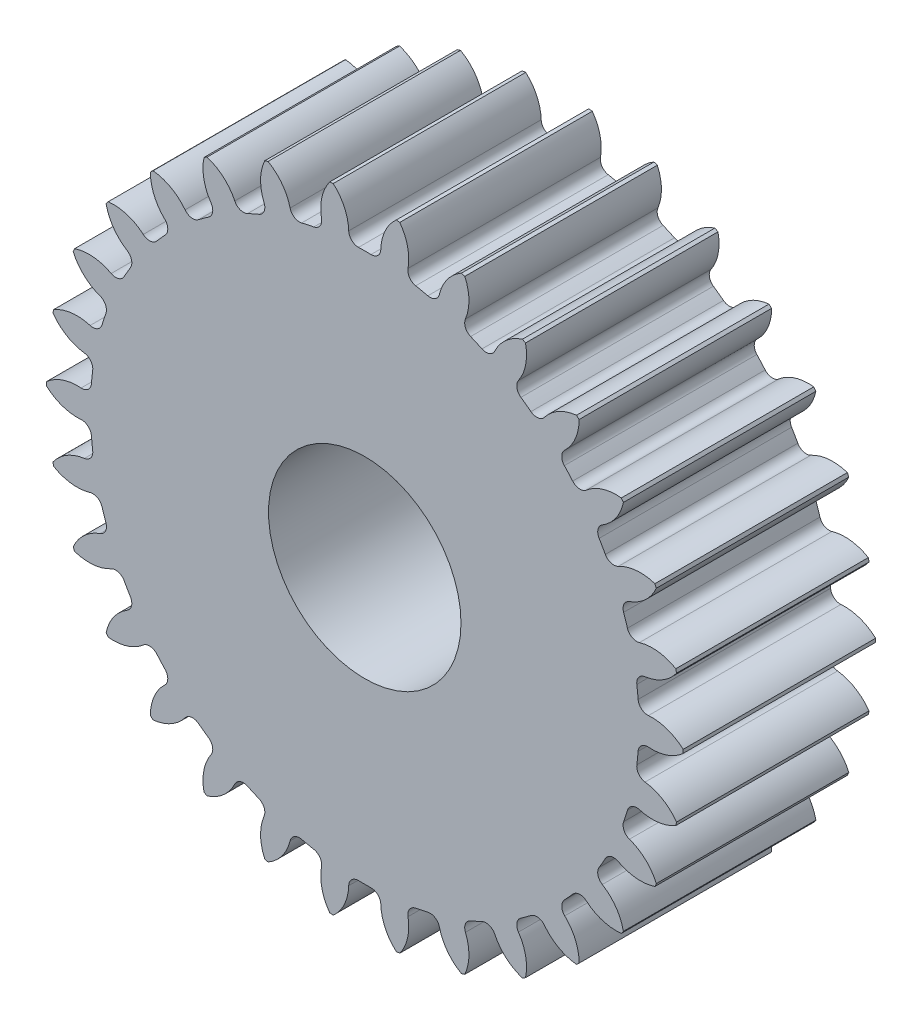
SolidWorks part; units mm, degrees
ref_plane "Front Plane" through (0, 0, 0) normal (0, 0, 1) x (1, 0, 0)
ref_plane "Top Plane" through (0, 0, 0) normal (0, 1, 0) x (1, 0, 0)
ref_plane "Right Plane" through (0, 0, 0) normal (1, 0, 0) x (0, 0, -1)
sketch "Sketch1" plane through (0, 0, 0) normal (0, 0, 1) x (1, 0, 0)
  circle A0 centre (0, 0) radius 2
  circle A1 centre (0, 0) radius 6.6165
  dimension "D1" = 4
  dimension "D2" = 13.233
extrude "Boss-Extrude1" add sketch "Sketch1" along normal blind 4
sketch "Sketch2" plane through (0, 0, 4) normal (0, 0, 1) x (1, 0, 0)
  line L0 (0, 5.6996) -> (0, 6.6165) construction
  line L2 (-0.5367, 6.5947) -> (-0.6726, 6.9681) construction
  circle A0 centre (0, 0) radius 6.6165 construction
  arc A2 (0.3499, 5.6888) -> (-0.3499, 5.6888) centre (0, 0) ccw
  arc A3 (0.655, 6.584) -> (-0.655, 6.584) centre (0, 0) ccw
  arc A4 (-0.655, 6.584) -> (-0.3499, 5.6888) centre (-1.2945, 5.8665) cw
  arc A5 (0.655, 6.584) -> (0.3499, 5.6888) centre (1.2945, 5.8665) ccw
  point P7 (-0.6726, 6.9681)
  point P8 (-0.3499, 5.6996)
  dimension "D1" = 20
extrude "Cut-Extrude1" cut sketch "Sketch2" against normal blind 13
fillet "Fillet3" radius 0.2 2 edges at (0.3499, 5.6888, 2) (-0.3499, 5.6888, 2)
pattern_circular "CirPattern5" count 30 over 360 about axis through (0, 0, 0) along (0, 0, 1) of "Fillet3", "Cut-Extrude1"
